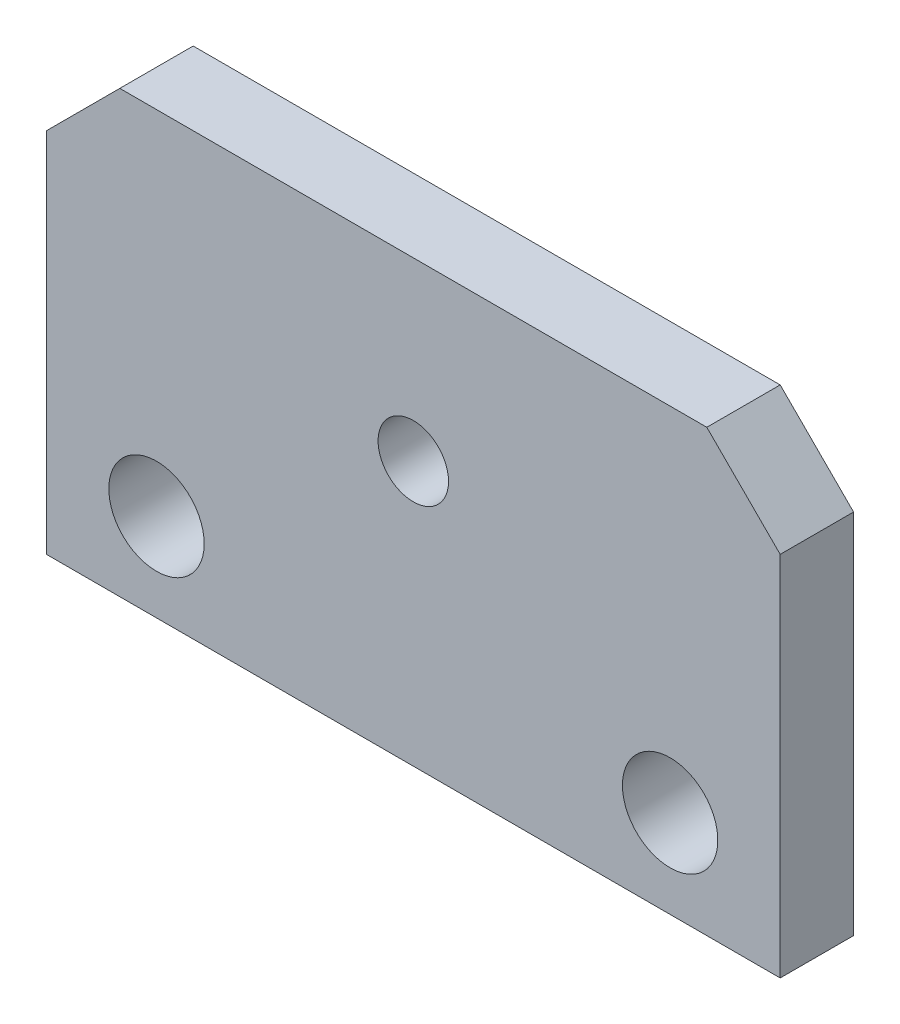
SolidWorks part; units mm, degrees
ref_plane "Face" through (0, 0, 0) normal (0, 0, 1) x (1, 0, 0)
ref_plane "Dessus" through (0, 0, 0) normal (0, 1, 0) x (1, 0, 0)
ref_plane "Droite" through (0, 0, 0) normal (1, 0, 0) x (0, 0, -1)
sketch "Esquisse1" plane through (0, 0, 0) normal (0, 0, 1) x (1, 0, 0)
  line L1 (-25, 0) -> (25, 0)
  line L2 (-25, 0) -> (-25, 30)
  line L3 (-25, 30) -> (25, 30)
  line L4 (25, 0) -> (25, 30)
  dimension "D1" = 50
  dimension "D2" = 30
  dimension "D3" = 25
extrude "Extrusion1" add sketch "Esquisse1" along normal blind 5
chamfer "Chanfrein1" distance 5 angle 45
sketch "Esquisse2" plane through (0, 0, 5) normal (0, 0, 1) x (1, 0, 0)
  line L0 (0, -7.0895) -> (0, 34.5298) construction
  line L1 (-25, 0) -> (25, 0) construction
  circle A0 centre (-17.5, 6) radius 3.25
  circle A1 centre (17.5, 6) radius 3.25
  dimension "D1" = 6.5
  dimension "D2" = 6
  dimension "D3" = 17.5
extrude "Enlèv. mat.-Extru.1" cut sketch "Esquisse2" against normal through all
hole_wizard "Trou taraudé M6x1.01" positions "Esquisse4" profile "Esquisse3" tap size "M6x1.0" standard "ISO"
sketch "Esquisse4" plane through (0, 0, 5) normal (0, 0, 1) x (1, 0, 0)
  line L0 (0, 0) -> (0, 35.8874) construction
  line L1 (20, 30) -> (-20, 30) construction
  point P0 (0, 18)
  dimension "D1" = 12
sketch "Esquisse3" plane through (0, 18, 5) normal (1, 0, 0) x (0, -1, 0)
  line L0 (0, 0) -> (0, 5)
  line L1 (0, 5) -> (2.4, 5)
  line L2 (2.4, 5) -> (2.4, 0)
  line L5 (2.4, 0) -> (0, 0)
  line L11 (0, -6.35) -> (0, 107.95) construction
  dimension "Diamètre du trou pour taraudage jusqu'au prochain" = 4.8
  dimension "Profondeur du trou pour taraudage jusqu'au prochain" = 5
